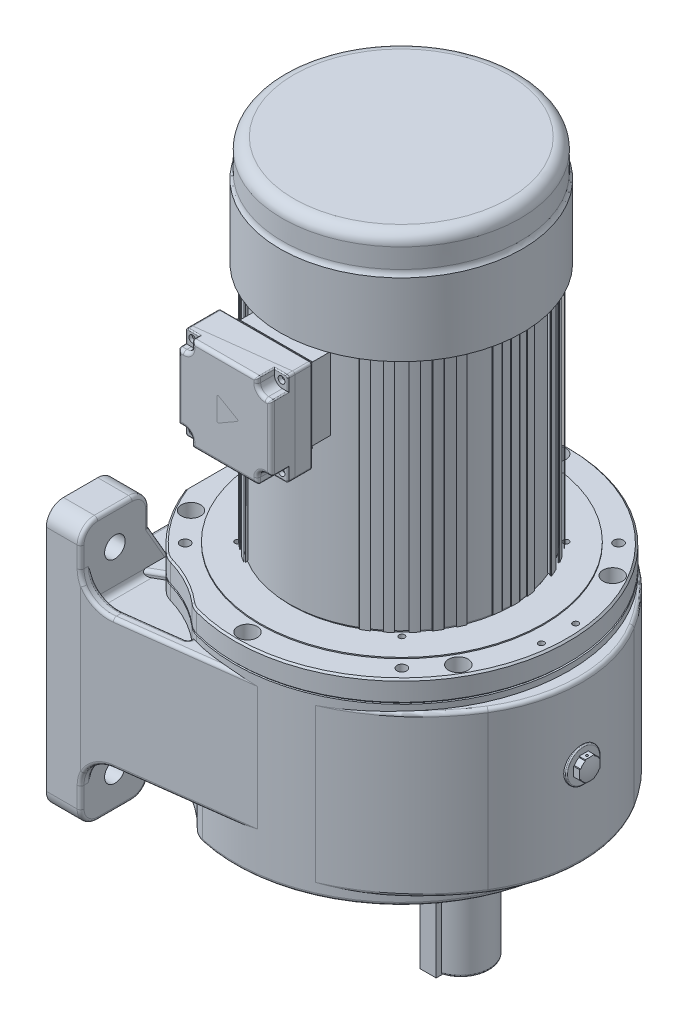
SolidWorks part; units mm, degrees
ref_plane "前视基准面" through (0, 0, 0) normal (0, 0, 1) x (1, 0, 0)
ref_plane "上视基准面" through (0, 0, 0) normal (0, 1, 0) x (1, 0, 0)
ref_plane "右视基准面" through (0, 0, 0) normal (1, 0, 0) x (0, 0, -1)
imported_body "接线盒座-1-surface1"
imported_body "接线盒座-1-surface2"
imported_body "接线盒座-1-surface3"
imported_body "接线盒座-1-surface4"
imported_body "接线盒盖-1-surface1"
imported_body "接线盒盖-1-surface2"
imported_body "接线盒盖-1-surface3"
imported_body "接线盒盖-1-surface4"
imported_body "50箱盖-1-surface1"
imported_body "卧式箱体-1-surface1"
imported_body "卧式箱体-1-surface2"
imported_body "卧式箱体-1-surface3"
imported_body "复件 5034.2200.106-00-1-surface2"
imported_body "复件 5034.2200.106-00-1-surface3"
imported_body "复件 5034.2200.106-00-1-surface4"
imported_body "复件 5034.2200.106-00-1-surface5"
imported_body "复件 5034.2200.106-00-1-surface6"
imported_body "复件 5034.2200.106-00-1-surface7"
imported_body "复件 5034.2200.106-00-1-surface8"
imported_body "复件 5034.2200.106-00-1-surface9"
imported_body "复件 5034.2200.106-00-1-surface10"
imported_body "复件 5034.2200.106-00-1-surface11"
imported_body "复件 5034.2200.106-00-1-surface12"
imported_body "复件 5034.2200.106-00-1-surface13"
imported_body "复件 5034.2200.106-00-1-surface14"
imported_body "复件 5034.2200.106-00-1-surface15"
imported_body "复件 5034.2200.106-00-1-surface16"
imported_body "复件 5034.2200.106-00-1-surface17"
imported_body "复件 5034.2200.106-00-1-surface18"
imported_body "复件 5034.2200.106-00-1-surface19"
imported_body "复件 5034.2200.106-00-1-surface20"
imported_body "复件 5034.2200.106-00-1-surface21"
imported_body "复件 5034.2200.106-00-1-surface22"
imported_body "复件 5034.2200.106-00-1-surface23"
imported_body "复件 5034.2200.106-00-1-surface24"
imported_body "复件 5034.2200.106-00-1-surface25"
imported_body "复件 5034.2200.106-00-1-surface26"
imported_body "复件 5034.2200.106-00-1-surface27"
imported_body "复件 5034.2200.106-00-1-surface28"
imported_body "复件 5034.2200.106-00-1-surface29"
imported_body "复件 5034.2200.106-00-1-surface30"
imported_body "复件 5034.2200.106-00-1-surface31"
imported_body "复件 5034.2200.106-00-1-surface32"
imported_body "复件 5034.2200.106-00-1-surface33"
imported_body "复件 5034.2200.106-00-1-surface34"
imported_body "复件 5034.2200.106-00-1-surface35"
imported_body "复件 5034.2200.106-00-1-surface36"
imported_body "复件 5034.2200.106-00-1-surface37"
imported_body "复件 5034.2200.106-00-1-surface38"
imported_body "复件 5034.2200.106-00-1-surface39"
imported_body "复件 5034.2200.106-00-1-surface40"
imported_body "复件 5034.2200.106-00-1-surface41"
imported_body "复件 5034.2200.106-00-1-surface42"
imported_body "复件 5034.2200.106-00-1-surface43"
imported_body "复件 5034.2200.106-00-1-surface44"
imported_body "复件 5034.2200.106-00-1-surface45"
imported_body "复件 5034.2200.106-00-1-surface46"
imported_body "复件 5034.2200.106-00-1-surface47"
imported_body "复件 5034.2200.106-00-1-surface48"
imported_body "复件 5034.2200.106-00-1-surface49"
imported_body "复件 5034.2200.106-00-1-surface50"
imported_body "复件 5034.2200.106-00-1-surface51"
imported_body "复件 5034.2200.106-00-1-surface52"
imported_body "复件 5034.2200.106-00-1-surface53"
imported_body "复件 5034.2200.106-00-1-surface54"
imported_body "复件 5034.2200.106-00-1-surface55"
imported_body "复件 5034.2200.106-00-1-surface56"
imported_body "复件 5034.2200.106-00-1-surface57"
imported_body "复件 5034.2200.106-00-1-surface58"
imported_body "复件 5034.2200.106-00-1-surface59"
imported_body "复件 5034.2200.106-00-1-surface60"
imported_body "复件 5034.2200.106-00-1-surface61"
imported_body "透气塞-1-surface1"
sketch "草图1" plane through (0, -194.2551, 0) normal (0, 1, 0) x (1, 0, 0)
  circle A0 centre (15.5509, 127.454) radius 98
  circle A1 centre (67.5509, 127.454) radius 52 construction
extrude "凸台-拉伸1" add sketch "草图1" along normal blind 209.5
sketch "草图2" plane through (0, 15.2449, 0) normal (0, 1, 0) x (1, 0, 0)
  circle A0 centre (15.5509, 127.454) radius 106
extrude "凸台-拉伸2" add sketch "草图2" along normal blind 63.5
sketch "草图3" plane through (0, 78.7449, 0) normal (0, 1, 0) x (1, 0, 0)
  circle A0 centre (15.5509, 127.454) radius 104
extrude "凸台-拉伸3" add sketch "草图3" along normal blind 32
fillet "圆角1" radius 10 1 edges at (15.5509, 110.7449, -23.454)
fillet "圆角2" radius 7 1 edges at (15.5509, 78.7449, -23.454)
